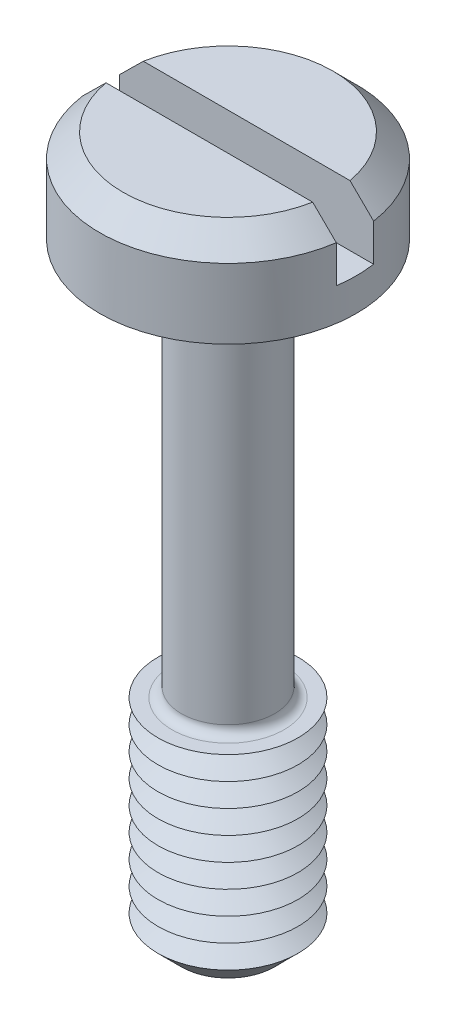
SolidWorks part; units mm, degrees
ref_plane "Front Plane" through (0, 0, 0) normal (0, 0, 1) x (1, 0, 0)
ref_plane "Top Plane" through (0, 0, 0) normal (0, 1, 0) x (1, 0, 0)
ref_plane "Right Plane" through (0, 0, 0) normal (1, 0, 0) x (0, 0, -1)
sketch "Sketch1" plane through (0, 0, 0) normal (0, 1, 0) x (1, 0, 0)
  circle A0 centre (0, 0) radius 2.75
  dimension "D1" = 5.5
extrude "Boss-Extrude1" add sketch "Sketch1" along normal blind 2
sketch "Sketch2" plane through (0, 0, 0) normal (0, -1, 0) x (1, 0, 0)
  circle A0 centre (0, 0) radius 1
  dimension "D1" = 2
extrude "Boss-Extrude2" add sketch "Sketch2" along normal blind 13
sketch "Sketch3" plane through (0, -13, 0) normal (0, -1, 0) x (1, 0, 0)
  circle A0 centre (0, 0) radius 1.5
  dimension "D1" = 3
extrude "Boss-Extrude3" add sketch "Sketch3" against normal blind 4.5
chamfer "Chamfer1" distance 0.5 angle 45 1 edges at (0, -13, -1.5)
sketch "Sketch4" plane through (0, 0, 0) normal (1, 0, 0) x (0, 0, -1)
  line L0 (0, -6.5871) -> (0, -12.0372) construction
sketch "Sketch5" plane through (0, 0, 0) normal (1, 0, 0) x (0, 0, -1)
  line L0 (-1.5, -8.5) -> (-1.067, -8.75)
  line L1 (-1.067, -8.75) -> (-1.5, -9)
  line L2 (-1.5, -8.5) -> (-1.5, -12.5) construction
  line L3 (-1.5, -9) -> (-1.5, -8.5)
  dimension "D1" = 0.5
revolve "Cut-Revolve1" cut sketch "Sketch5" angle 360 about L0
pattern_linear "LPattern1" count 8 spacing 0.5 along (0, -1, 0) of "Cut-Revolve1"
fillet "Fillet1" radius 0.2 2 edges at (0, -8.5, -1) (0, 0, -1)
chamfer "Chamfer2" distance 0.5 angle 45 1 edges at (0, 2, 2.75)
sketch "Sketch6" plane through (0, 2, 0) normal (0, 1, 0) x (1, 0, 0)
  line L1 (2.75, -0.4) -> (-2.75, -0.4)
  line L2 (2.75, -0.4) -> (2.75, 0.4)
  line L3 (2.75, 0.4) -> (-2.75, 0.4)
  line L4 (-2.75, -0.4) -> (-2.75, 0.4)
  line L5 (2.75, -0.4) -> (-2.75, 0.4) construction
  line L6 (2.75, 0.4) -> (-2.75, -0.4) construction
  circle A0 centre (0, 0) radius 2.75 construction
  point P0 (0, 0)
  dimension "D1" = 0.8
extrude "Cut-Extrude1" cut sketch "Sketch6" against normal blind 1.3
